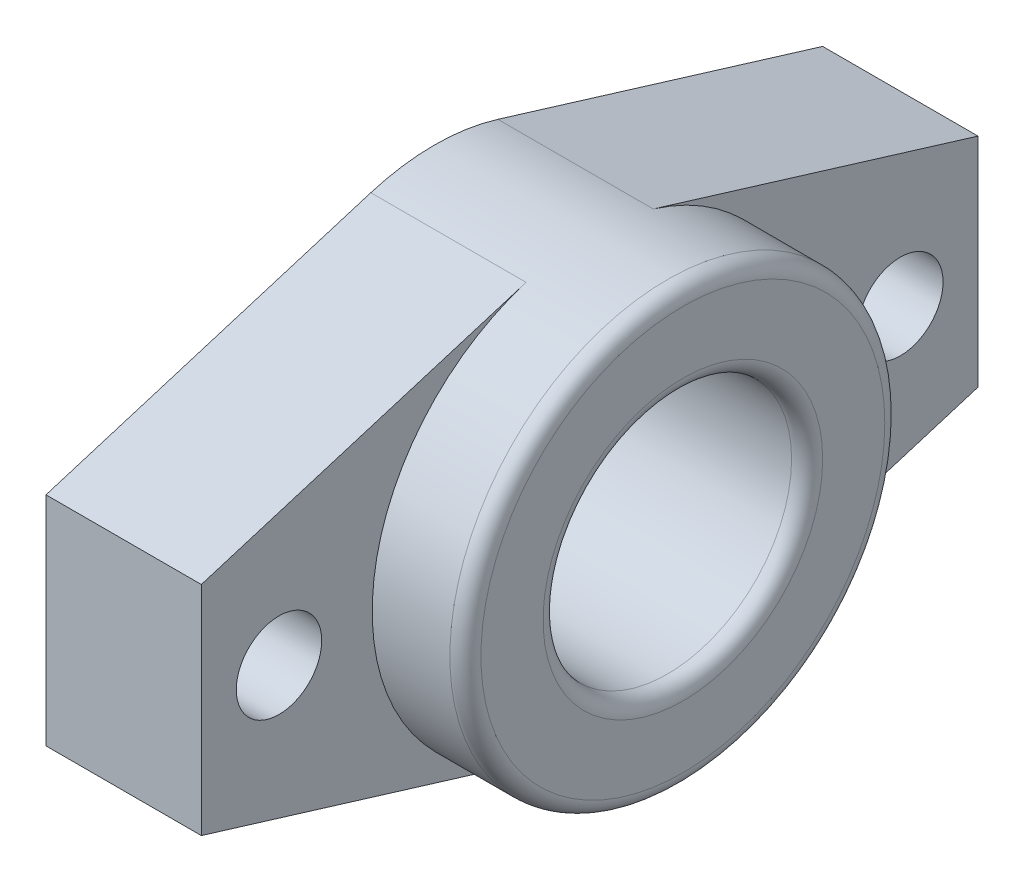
SolidWorks part; units mm, degrees
ref_plane "Front Plane" through (0, 0, 0) normal (0, 0, 1) x (1, 0, 0)
ref_plane "Top Plane" through (0, 0, 0) normal (0, 1, 0) x (1, 0, 0)
ref_plane "Right Plane" through (0, 0, 0) normal (1, 0, 0) x (0, 0, -1)
sketch "Sketch2" plane through (0, 0, 0) normal (1, 0, 0) x (0, 0, -1)
  line L0 (50, 7) -> (29.0911, 0.6111)
  line L2 (0, 7) -> (0, 21)
  line L4 (50, 7) -> (50, 21)
  line L6 (0, 21) -> (20.9089, 27.3889)
  line L7 (50, 21) -> (29.0911, 27.3889)
  line L8 (0, 7) -> (20.9089, 0.6111)
  arc A0 (29.0911, 27.3889) -> (20.9089, 27.3889) centre (25, 14) ccw
  arc A1 (29.0911, 0.6111) -> (20.9089, 0.6111) centre (25, 14) cw
extrude "Boss-Extrude1" add sketch "Sketch2" along normal blind 10
sketch "Sketch3" plane through (10, 0, 0) normal (1, 0, 0) x (0, 0, -1)
  circle A0 centre (25, 14) radius 14
extrude "Boss-Extrude2" add sketch "Sketch3" along normal blind 6
sketch "Sketch4" plane through (0, 0, 0) normal (-1, 0, 0) x (0, 0, 1)
  circle A0 centre (-45, 14) radius 2.75
  circle A1 centre (-25, 14) radius 8
  circle A2 centre (-5, 14) radius 2.75
extrude "Cut-Extrude1" cut sketch "Sketch4" against normal blind 16
fillet "Fillet1" radius 1 2 edges at (16, 14, -17) (16, 14, -39)
